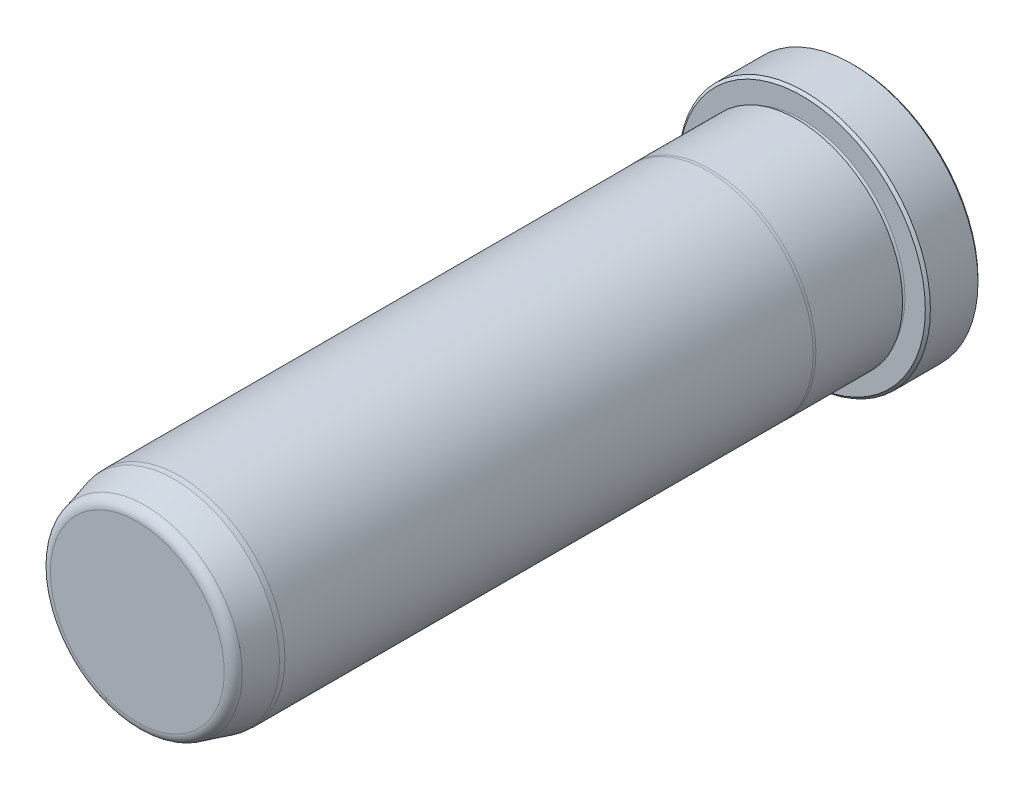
SolidWorks part; units mm, degrees
ref_plane "Front Plane" through (0, 0, 0) normal (0, 0, 1) x (1, 0, 0)
ref_plane "Top Plane" through (0, 0, 0) normal (0, 1, 0) x (1, 0, 0)
ref_plane "Right Plane" through (0, 0, 0) normal (1, 0, 0) x (0, 0, -1)
sketch "Sketch1" plane through (0, 0, 0) normal (1, 0, 0) x (0, 0, -1)
  line L0 (0, 0) -> (0, 18.923)
  line L1 (0, 18.923) -> (-7.9248, 18.923)
  line L2 (-7.9248, 18.923) -> (-7.9248, 15.4813)
  line L3 (-4.7498, 15.1003) -> (-5.5118, 15.1003) construction
  line L4 (-8.6868, 15.4813) -> (-8.6868, 15.8877)
  line L5 (-8.6868, 15.8877) -> (-21.7348, 15.8877)
  line L6 (-21.7348, 15.8877) -> (-22.098, 15.8623)
  line L7 (-22.098, 15.8623) -> (-101.6, 15.8623)
  line L9 (-107.95, 14.2983) -> (-107.95, 0)
  line L10 (-107.95, 0) -> (0, 0)
  line L11 (0, 0) -> (13.6287, 0) construction
  line L12 (-101.6, 15.8623) -> (-102.362, 15.7956)
  line L13 (-102.362, 15.7956) -> (-107.95, 14.2983)
  arc A0 (-8.6868, 15.4813) -> (-7.9248, 15.4813) centre (-8.3058, 15.4813) ccw
  dimension "D14" = 0.762
  dimension "D1" = 7.9248
  dimension "D2" = 0.762
  dimension "D3" = 37.846
  dimension "D4" = 31.7754
  dimension "D5" = 22.098
  dimension "D6" = 107.95
  dimension "D7" = 0.7874
  dimension "D8" = 4
  dimension "D9" = 31.7246
  dimension "D10" = 5
  dimension "D11" = 15
  dimension "D12" = 0.762
  dimension "D13" = 6.35
revolve "Revolve1" add sketch "Sketch1" angle 360 about L11
fillet "Fillet6" radius 1.5875 1 edges at (14.2983, 0, 107.95)
chamfer "Chamfer1" distance 0.381 angle 45 2 edges at (18.923, 0, 0) (18.923, 0, 7.9248)
